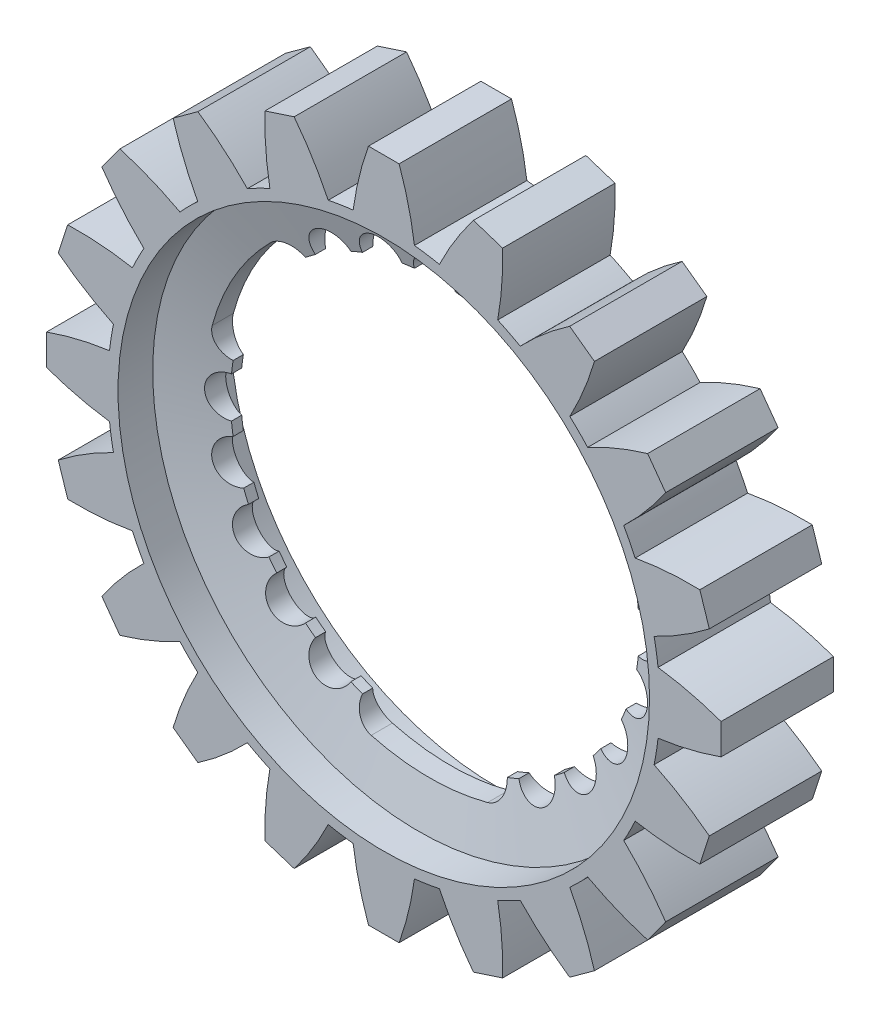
SolidWorks part; units mm, degrees
ref_plane "前视基准面" through (0, 0, 0) normal (0, 0, 1) x (1, 0, 0)
ref_plane "上视基准面" through (0, 0, 0) normal (0, 1, 0) x (1, 0, 0)
ref_plane "右视基准面" through (0, 0, 0) normal (1, 0, 0) x (0, 0, -1)
sketch "草图1" plane through (0, 0, 0) normal (0, 0, 1) x (1, 0, 0)
  circle A0 centre (0, 0) radius 13.5
extrude "凸台-拉伸1" add sketch "草图1" along normal blind 5.5
sketch "草图2" plane through (0, 0, 5.5) normal (0, 0, 1) x (1, 0, 0)
  circle A0 centre (0, 0) radius 10
extrude "切除-拉伸1" cut sketch "草图2" against normal through all
sketch "草图3" plane through (0, 0, 5.5) normal (0, 0, 1) x (1, 0, 0)
  circle A0 centre (0, 0) radius 13
extrude "切除-拉伸2" cut sketch "草图3" against normal blind 1.5
sketch "草图4" plane through (0, 0, 0) normal (0, 0, -1) x (-1, 0, 0)
  circle A0 centre (0, 0) radius 13
extrude "切除-拉伸3" cut sketch "草图4" against normal blind 1.5
chamfer "倒角1" distance 1 angle 75 2 edges at (-10, 0, 1.5) (10, 0, 4)
sketch "草图5" plane through (0, 0, 5.5) normal (0, 0, 1) x (1, 0, 0)
  arc A0 (-1.6105, 9.8695) -> (-3.54, 9.3525) centre (0, 0) ccw
  arc A1 (-4.1101, 9.1163) -> (-5.8399, 8.1176) centre (-5, 8.6603) ccw
  arc A2 (-1.6105, 9.8695) -> (-3.54, 9.3525) centre (-2.5882, 9.6593) ccw
  arc A3 (0.9987, 9.95) -> (-0.9987, 9.95) centre (0, 10) ccw
  arc A4 (3.54, 9.3525) -> (1.6105, 9.8695) centre (2.5882, 9.6593) ccw
  arc A5 (5.8399, 8.1176) -> (4.1101, 9.1163) centre (5, 8.6603) ccw
  arc A6 (-6.3295, 7.7419) -> (-7.7782, 7.7782) centre (-7.0711, 7.0711) ccw
  arc A7 (7.7782, 7.7782) -> (6.3295, 7.7419) centre (7.0711, 7.0711) ccw
  arc A8 (-4.1101, 9.1163) -> (-5.8399, 8.1176) centre (0, 0) ccw
  arc A9 (-6.3295, 7.7419) -> (-9.8695, 1.6105) centre (0, 0) ccw
  arc A10 (0.9987, 9.95) -> (-0.9987, 9.95) centre (0, 0) ccw
  arc A11 (3.54, 9.3525) -> (1.6105, 9.8695) centre (0, 0) ccw
  arc A12 (5.8399, 8.1176) -> (4.1101, 9.1163) centre (0, 0) ccw
  arc A13 (-9.95, 0.9987) -> (-9.95, -0.9987) centre (-10, 0) ccw
  arc A14 (-9.8695, -1.6105) -> (-9.3525, -3.54) centre (-9.6593, -2.5882) ccw
  arc A15 (-9.1163, -4.1101) -> (-8.1176, -5.8399) centre (-8.6603, -5) ccw
  arc A16 (-7.7419, -6.3295) -> (-6.3295, -7.7419) centre (-7.0711, -7.0711) ccw
  arc A17 (-5.8399, -8.1176) -> (-4.1101, -9.1163) centre (-5, -8.6603) ccw
  arc A18 (-3.54, -9.3525) -> (-2.847, -10.6252) centre (-2.5882, -9.6593) ccw
  arc A19 (-9.8695, -1.6105) -> (-9.3525, -3.54) centre (0, 0) ccw
  arc A20 (-9.1163, -4.1101) -> (-8.1176, -5.8399) centre (0, 0) ccw
  arc A21 (-7.7419, -6.3295) -> (-6.3295, -7.7419) centre (0, 0) ccw
  arc A22 (-5.8399, -8.1176) -> (-4.1101, -9.1163) centre (0, 0) ccw
  arc A23 (7.7419, -6.3295) -> (6.3295, -7.7419) centre (0, 0) cw
  arc A24 (9.1163, -4.1101) -> (8.1176, -5.8399) centre (0, 0) cw
  arc A25 (9.8695, -1.6105) -> (9.3525, -3.54) centre (0, 0) cw
  arc A26 (3.54, -9.3525) -> (2.847, -10.6252) centre (2.5882, -9.6593) cw
  arc A27 (5.8399, -8.1176) -> (4.1101, -9.1163) centre (5, -8.6603) cw
  arc A28 (7.7419, -6.3295) -> (6.3295, -7.7419) centre (7.0711, -7.0711) cw
  arc A29 (9.1163, -4.1101) -> (8.1176, -5.8399) centre (8.6603, -5) cw
  arc A30 (9.8695, -1.6105) -> (9.3525, -3.54) centre (9.6593, -2.5882) cw
  arc A31 (9.95, 0.9987) -> (9.95, -0.9987) centre (10, 0) cw
  arc A32 (4.1101, -9.1163) -> (5.8399, -8.1176) centre (0, 0) ccw
  arc A36 (9.95, -0.9987) -> (9.95, 0.9987) centre (0, 0) ccw
  arc A37 (10.6252, 2.847) -> (7.7782, 7.7782) centre (0, 0) ccw
  arc A38 (9.8695, 1.6105) -> (10.6252, 2.847) centre (9.6593, 2.5882) ccw
  arc A39 (-10.6252, 2.847) -> (-9.8695, 1.6105) centre (-9.6593, 2.5882) ccw
  arc A40 (9.8695, 1.6105) -> (6.3295, 7.7419) centre (0, 0) ccw
  arc A41 (-7.7782, 7.7782) -> (-10.6252, 2.847) centre (0, 0) ccw
  arc A42 (-2.847, -10.6252) -> (2.847, -10.6252) centre (0, 0) ccw
  arc A43 (-9.95, 0.9987) -> (-9.95, -0.9987) centre (0, 0) ccw
  arc A44 (-3.54, -9.3525) -> (3.54, -9.3525) centre (0, 0) ccw
extrude "切除-拉伸4" cut sketch "草图5" against normal through all
sketch "草图6" plane through (0, 0, 5.5) normal (0, 0, 1) x (1, 0, 0)
  line L0 (5.8121, 15.4607) -> (4.3855, 15.9242)
  line L1 (10.3052, 12.9079) -> (9.0917, 13.7896)
  line L2 (0.75, 16.5) -> (-0.75, 16.5)
  line L3 (13.7896, 9.0917) -> (12.9079, 10.3052)
  line L4 (15.9242, 4.3855) -> (15.4607, 5.8121)
  line L5 (16.5, -0.75) -> (16.5, 0.75)
  line L6 (15.4607, -5.8121) -> (15.9242, -4.3855)
  line L7 (12.9079, -10.3052) -> (13.7896, -9.0917)
  line L8 (9.0917, -13.7896) -> (10.3052, -12.9079)
  line L9 (4.3855, -15.9242) -> (5.8121, -15.4607)
  line L10 (-0.75, -16.5) -> (0.75, -16.5)
  line L11 (-5.8121, -15.4607) -> (-4.3855, -15.9242)
  line L12 (-10.3052, -12.9079) -> (-9.0917, -13.7896)
  line L13 (-13.7896, -9.0917) -> (-12.9079, -10.3052)
  line L14 (-15.9242, -4.3855) -> (-15.4607, -5.8121)
  line L15 (-16.5, 0.75) -> (-16.5, -0.75)
  line L16 (-15.4607, 5.8121) -> (-15.9242, 4.3855)
  line L17 (-12.9079, 10.3052) -> (-13.7896, 9.0917)
  line L18 (-9.0917, 13.7896) -> (-10.3052, 12.9079)
  line L19 (-4.3855, 15.9242) -> (-5.8121, 15.4607)
  arc A0 (1.5, 13.4164) -> (-1.5, 13.4164) centre (0, 0) ccw
  arc A1 (-0.75, 16.5) -> (-1.5, 13.4164) centre (13.6132, 11.3735) ccw
  arc A2 (0.75, 16.5) -> (1.5, 13.4164) centre (-13.6132, 11.3735) cw
  arc A3 (5.5725, 12.2962) -> (2.7193, 13.2233) centre (0, 0) ccw
  arc A4 (4.3855, 15.9242) -> (2.7193, 13.2233) centre (16.4616, 6.6101) ccw
  arc A5 (5.8121, 15.4607) -> (5.5725, 12.2962) centre (-9.4324, 15.0236) cw
  arc A6 (9.0995, 9.9724) -> (6.6724, 11.7358) centre (0, 0) ccw
  arc A7 (9.0917, 13.7896) -> (6.6724, 11.7358) centre (17.6985, 1.1997) ccw
  arc A8 (10.3052, 12.9079) -> (9.0995, 9.9724) centre (-4.3282, 17.203) cw
  arc A9 (11.7358, 6.6724) -> (9.9724, 9.0995) centre (0, 0) ccw
  arc A10 (12.9079, 10.3052) -> (9.9724, 9.0995) centre (17.203, -4.3282) ccw
  arc A11 (13.7896, 9.0917) -> (11.7358, 6.6724) centre (1.1997, 17.6985) cw
  arc A12 (13.2233, 2.7193) -> (12.2962, 5.5725) centre (0, 0) ccw
  arc A13 (15.4607, 5.8121) -> (12.2962, 5.5725) centre (15.0236, -9.4324) ccw
  arc A14 (15.9242, 4.3855) -> (13.2233, 2.7193) centre (6.6101, 16.4616) cw
  arc A15 (13.4164, -1.5) -> (13.4164, 1.5) centre (0, 0) ccw
  arc A16 (16.5, 0.75) -> (13.4164, 1.5) centre (11.3735, -13.6132) ccw
  arc A17 (16.5, -0.75) -> (13.4164, -1.5) centre (11.3735, 13.6132) cw
  arc A18 (12.2962, -5.5725) -> (13.2233, -2.7193) centre (0, 0) ccw
  arc A19 (15.9242, -4.3855) -> (13.2233, -2.7193) centre (6.6101, -16.4616) ccw
  arc A20 (15.4607, -5.8121) -> (12.2962, -5.5725) centre (15.0236, 9.4324) cw
  arc A21 (9.9724, -9.0995) -> (11.7358, -6.6724) centre (0, 0) ccw
  arc A22 (13.7896, -9.0917) -> (11.7358, -6.6724) centre (1.1997, -17.6985) ccw
  arc A23 (12.9079, -10.3052) -> (9.9724, -9.0995) centre (17.203, 4.3282) cw
  arc A24 (6.6724, -11.7358) -> (9.0995, -9.9724) centre (0, 0) ccw
  arc A25 (10.3052, -12.9079) -> (9.0995, -9.9724) centre (-4.3282, -17.203) ccw
  arc A26 (9.0917, -13.7896) -> (6.6724, -11.7358) centre (17.6985, -1.1997) cw
  arc A27 (2.7193, -13.2233) -> (5.5725, -12.2962) centre (0, 0) ccw
  arc A28 (5.8121, -15.4607) -> (5.5725, -12.2962) centre (-9.4324, -15.0236) ccw
  arc A29 (4.3855, -15.9242) -> (2.7193, -13.2233) centre (16.4616, -6.6101) cw
  arc A30 (-1.5, -13.4164) -> (1.5, -13.4164) centre (0, 0) ccw
  arc A31 (0.75, -16.5) -> (1.5, -13.4164) centre (-13.6132, -11.3735) ccw
  arc A32 (-0.75, -16.5) -> (-1.5, -13.4164) centre (13.6132, -11.3735) cw
  arc A33 (-5.5725, -12.2962) -> (-2.7193, -13.2233) centre (0, 0) ccw
  arc A34 (-4.3855, -15.9242) -> (-2.7193, -13.2233) centre (-16.4616, -6.6101) ccw
  arc A35 (-5.8121, -15.4607) -> (-5.5725, -12.2962) centre (9.4324, -15.0236) cw
  arc A36 (-9.0995, -9.9724) -> (-6.6724, -11.7358) centre (0, 0) ccw
  arc A37 (-9.0917, -13.7896) -> (-6.6724, -11.7358) centre (-17.6985, -1.1997) ccw
  arc A38 (-10.3052, -12.9079) -> (-9.0995, -9.9724) centre (4.3282, -17.203) cw
  arc A39 (-11.7358, -6.6724) -> (-9.9724, -9.0995) centre (0, 0) ccw
  arc A40 (-12.9079, -10.3052) -> (-9.9724, -9.0995) centre (-17.203, 4.3282) ccw
  arc A41 (-13.7896, -9.0917) -> (-11.7358, -6.6724) centre (-1.1997, -17.6985) cw
  arc A42 (-13.2233, -2.7193) -> (-12.2962, -5.5725) centre (0, 0) ccw
  arc A43 (-15.4607, -5.8121) -> (-12.2962, -5.5725) centre (-15.0236, 9.4324) ccw
  arc A44 (-15.9242, -4.3855) -> (-13.2233, -2.7193) centre (-6.6101, -16.4616) cw
  arc A45 (-13.4164, 1.5) -> (-13.4164, -1.5) centre (0, 0) ccw
  arc A46 (-16.5, -0.75) -> (-13.4164, -1.5) centre (-11.3735, 13.6132) ccw
  arc A47 (-16.5, 0.75) -> (-13.4164, 1.5) centre (-11.3735, -13.6132) cw
  arc A48 (-12.2962, 5.5725) -> (-13.2233, 2.7193) centre (0, 0) ccw
  arc A49 (-15.9242, 4.3855) -> (-13.2233, 2.7193) centre (-6.6101, 16.4616) ccw
  arc A50 (-15.4607, 5.8121) -> (-12.2962, 5.5725) centre (-15.0236, -9.4324) cw
  arc A51 (-9.9724, 9.0995) -> (-11.7358, 6.6724) centre (0, 0) ccw
  arc A52 (-13.7896, 9.0917) -> (-11.7358, 6.6724) centre (-1.1997, 17.6985) ccw
  arc A53 (-12.9079, 10.3052) -> (-9.9724, 9.0995) centre (-17.203, -4.3282) cw
  arc A54 (-6.6724, 11.7358) -> (-9.0995, 9.9724) centre (0, 0) ccw
  arc A55 (-10.3052, 12.9079) -> (-9.0995, 9.9724) centre (4.3282, 17.203) ccw
  arc A56 (-9.0917, 13.7896) -> (-6.6724, 11.7358) centre (-17.6985, 1.1997) cw
  arc A57 (-2.7193, 13.2233) -> (-5.5725, 12.2962) centre (0, 0) ccw
  arc A58 (-5.8121, 15.4607) -> (-5.5725, 12.2962) centre (9.4324, 15.0236) ccw
  arc A59 (-4.3855, 15.9242) -> (-2.7193, 13.2233) centre (-16.4616, 6.6101) cw
  point P125 (0, 0)
  dimension "D1" = 20
extrude "凸台-拉伸2" add sketch "草图6" against normal up to surface (5.5 mm away)
